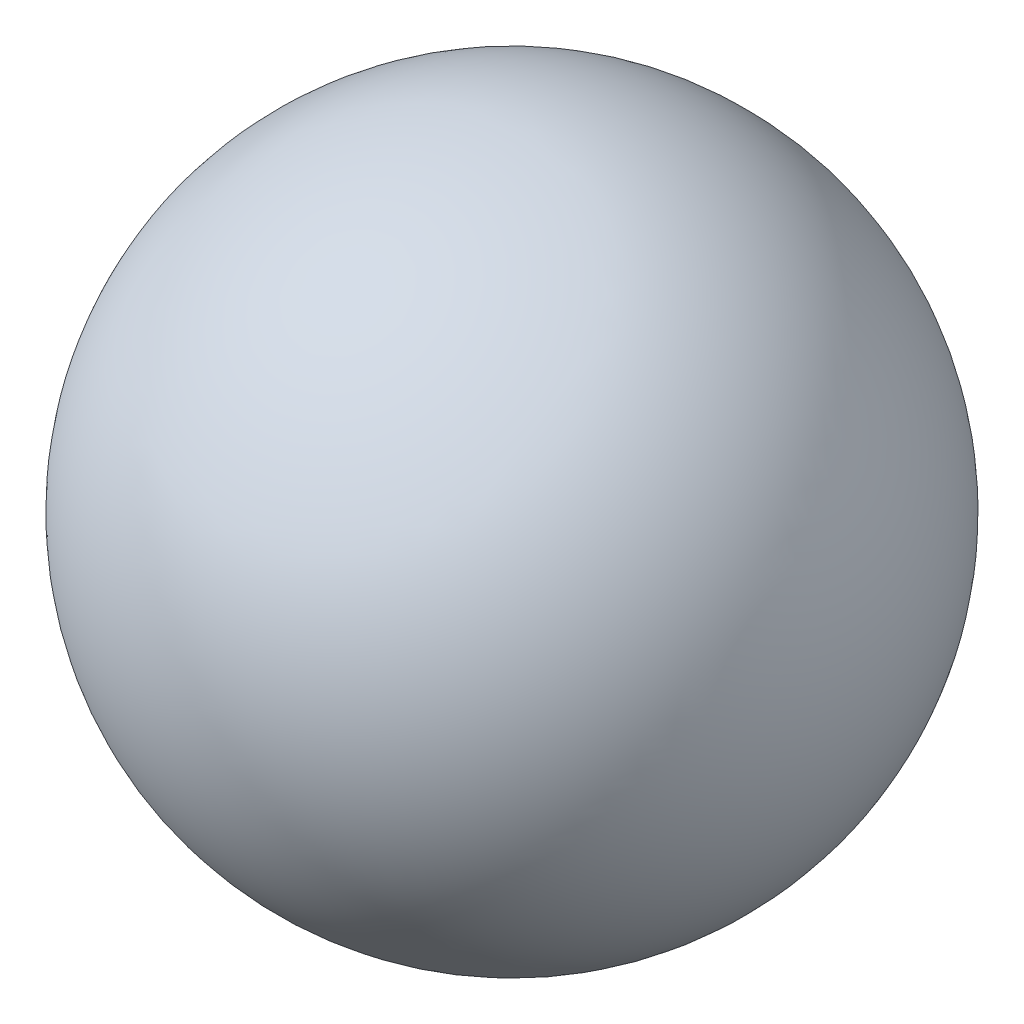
SolidWorks part; units mm, degrees
ref_plane "Front" through (0, 0, 0) normal (0, 0, 1) x (1, 0, 0)
ref_plane "Top" through (0, 0, 0) normal (0, 1, 0) x (1, 0, 0)
ref_plane "Right" through (0, 0, 0) normal (1, 0, 0) x (0, 0, -1)
sketch "Sketch1" plane through (0, 0, 0) normal (0, 0, 1) x (1, 0, 0)
  line L0 (-50, 0) -> (50, 0)
  line L1 (-76.8631, 0) -> (70.1305, 0) construction
  arc A0 (50, 0) -> (-50, 0) centre (0, 0) ccw
  dimension "D1" = 50
revolve "Revolve1" add sketch "Sketch1" angle 360 about L1
ref_plane "Plane2" through (0, 60, 0) normal (0, 1, 0) x (-1, 0, 0)
sketch "Sketch2" plane through (0, 60, 0) normal (0, 1, 0) x (-1, 0, 0)
  ellipse E0 centre (0, 0) end of major axis (-48.0747, 0) minor radius 28.6238
